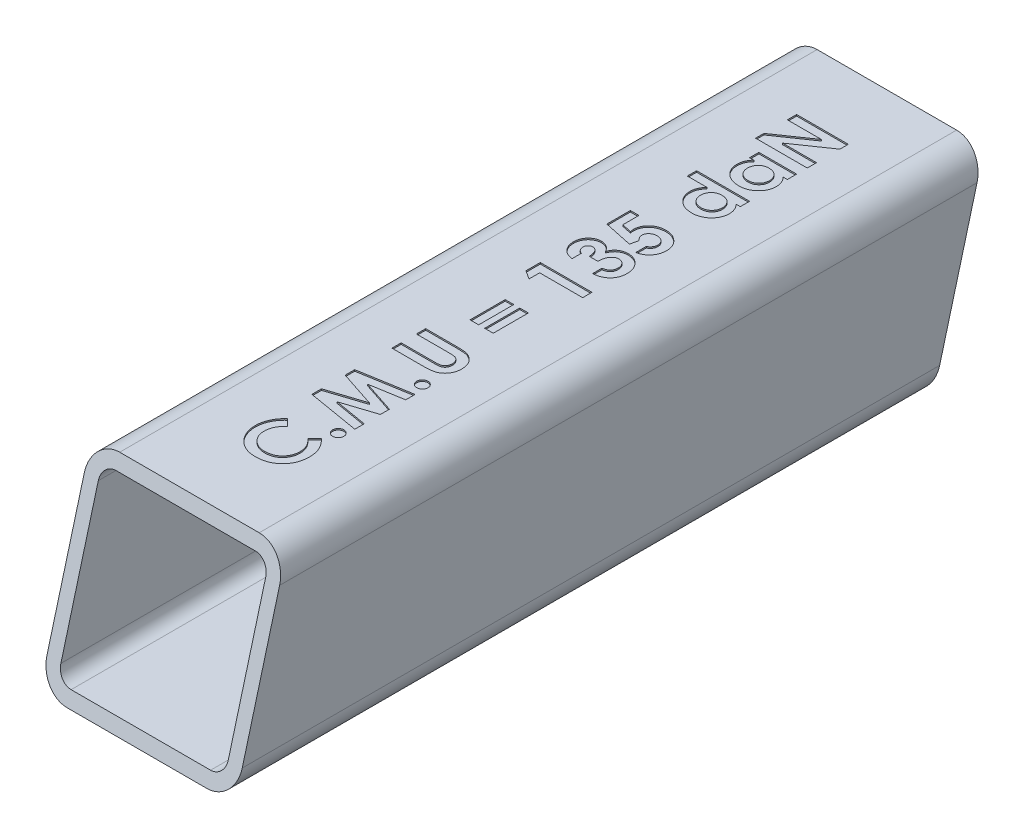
SolidWorks part; units mm, degrees
other "Objet de détail1"
ref_plane "Plan de face" through (0, 0, 0) normal (0, 0, 1) x (1, 0, 0)
ref_plane "Plan de dessus" through (0, 0, 0) normal (0, 1, 0) x (1, 0, 0)
ref_plane "Plan de droite" through (0, 0, 0) normal (1, 0, 0) x (0, 0, -1)
sketch "Esquisse1" plane through (0, 0, 0) normal (0, 0, 1) x (1, 0, 0)
  line L0 (-25, 30) -> (25, 30)
  line L1 (-25, 35) -> (25, 35)
  line L2 (-35, 25) -> (-35, -25)
  line L3 (-25, -35) -> (25, -35)
  line L4 (35, 25) -> (35, -25)
  line L5 (30, 25) -> (30, -25)
  line L6 (-25, -30) -> (25, -30)
  line L7 (-30, 25) -> (-30, -25)
  arc A0 (-25, 35) -> (-35, 25) centre (-25, 25) ccw
  arc A1 (25, 35) -> (35, 25) centre (25, 25) cw
  arc A2 (-25, -35) -> (-35, -25) centre (-25, -25) cw
  arc A3 (25, -35) -> (35, -25) centre (25, -25) ccw
  arc A4 (25, 30) -> (30, 25) centre (25, 25) cw
  arc A5 (25, -30) -> (30, -25) centre (25, -25) ccw
  arc A6 (-25, -30) -> (-30, -25) centre (-25, -25) cw
  arc A7 (-25, 30) -> (-30, 25) centre (-25, 25) ccw
  point P4 (0, -35)
  point P5 (-35, 0)
  dimension "D1" = 10
  dimension "D2" = 10
  dimension "D3" = 10
  dimension "D4" = 70
  dimension "D5" = 70
  dimension "D6" = 5
extrude "Boss.-Extru.1" add sketch "Esquisse1" along normal blind 270
sketch "Esquisse2" plane through (0, 0, 0) normal (1, 0, 0) x (0, 0, -1)
  line L0 (0, 35) -> (0, -35)
  line L1 (-18.7564, -35) -> (0, 35)
  line L2 (-308.034, 0) -> (34.7264, 0) construction
  line L3 (-270, -35) -> (0, -35) construction
  line L4 (0, -35) -> (-18.7564, -35)
  line L5 (-268.7564, -35) -> (-250, 35)
  line L6 (-270, 35) -> (-270, -35)
  line L7 (-270, 35) -> (0, 35) construction
  line L8 (-270, 35) -> (-250, 35)
  line L9 (-270, -35) -> (-268.7564, -35)
  point P8 (-9.3782, 0)
  point P9 (-259.3782, 0)
  dimension "D2" = 250
  dimension "D3" = 75
extrude "Enlèv. mat.-Extru.2" cut sketch "Esquisse2" against normal mid plane 250
sketch "Esquisse6" plane through (0, 35, 0) normal (0, 1, 0) x (1, 0, 0)
  line L0 (10, -228.2655) -> (10, 18.9206) construction
  line L1 (25, -250) -> (25, 0) construction
  text T0 "<b>C.M.U = 135 daN</b>" font "Century Gothic" height in points 70
  dimension "D1" = 15
extrude "Enlèv. mat.-Extru.4" cut sketch "Esquisse6" against normal blind 0.5
